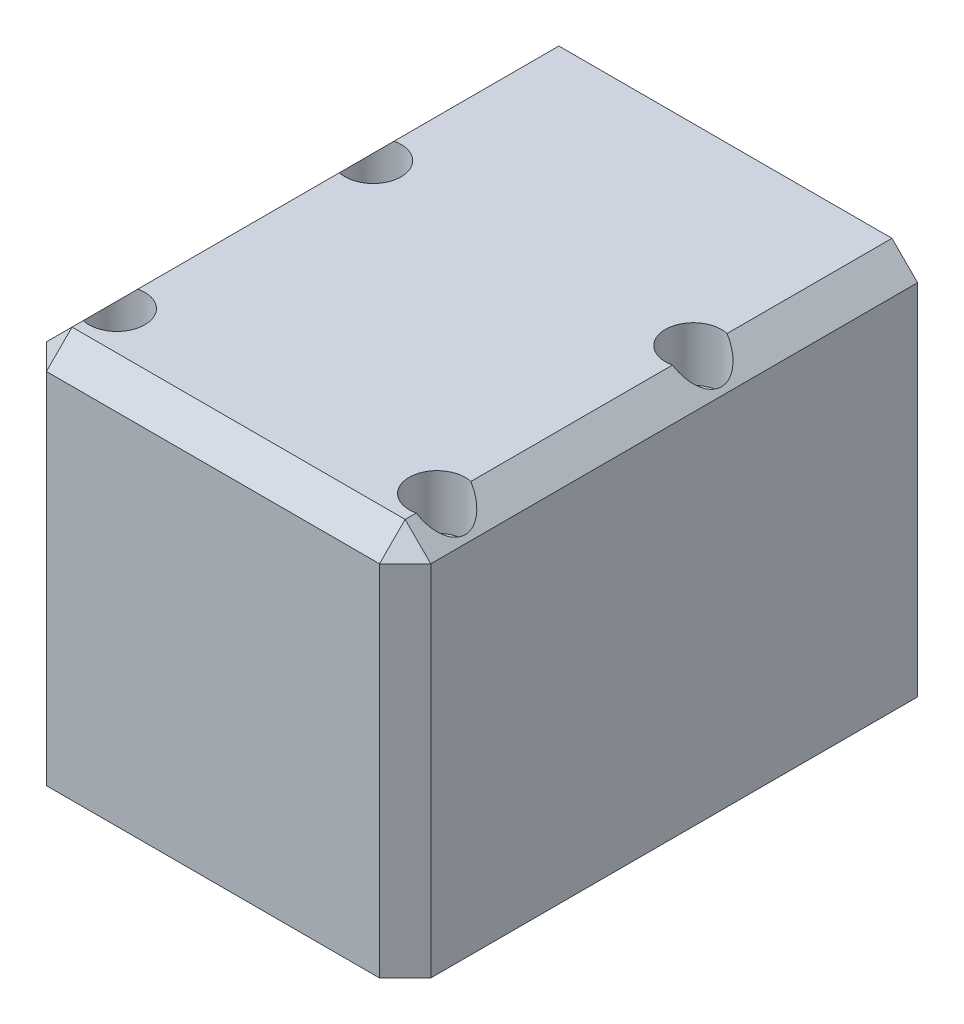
SolidWorks part; units mm, degrees
ref_plane "Front Plane" through (0, 0, 0) normal (0, 0, 1) x (1, 0, 0)
ref_plane "Top Plane" through (0, 0, 0) normal (0, 1, 0) x (1, 0, 0)
ref_plane "Right Plane" through (0, 0, 0) normal (1, 0, 0) x (0, 0, -1)
sketch "Sketch1" plane through (0, 0, 0) normal (0, 0, 1) x (1, 0, 0)
  line L1 (0, 0) -> (38.1, 0)
  line L2 (0, 0) -> (0, 38.1)
  line L3 (0, 38.1) -> (38.1, 38.1)
  line L4 (38.1, 0) -> (38.1, 38.1)
  dimension "D1" = 38.1
  dimension "D2" = 38.1
extrude "Extrude1" add sketch "Sketch1" along normal blind 50.8
sketch "Sketch2" plane through (0, 0, 0) normal (0, 0, -1) x (-1, 0, 0)
  line L0 (0, 19.05) -> (-13.4175, 19.05) construction
  line L1 (0, 38.1) -> (0, 0) construction
  line L2 (-19.05, 0) -> (-19.05, 14.7872) construction
  line L3 (0, 0) -> (-38.1, 0) construction
  circle A0 centre (-19.05, 19.05) radius 13.97
  dimension "D1" = 27.94
extrude "Cut-Extrude1" cut sketch "Sketch2" against normal blind 44.45
hole_wizard "#4-40 Tapped Hole1" positions "Sketch4" profile "Sketch3" tap size "#4-40" standard "Ansi Inch"
sketch "Sketch4" plane through (0, 0, 0) normal (0, 0, -1) x (-1, 0, 0)
  line L0 (-38.1, 19.05) -> (-2.1563, 19.05) construction
  line L1 (-38.1, 0) -> (-38.1, 38.1) construction
  line L2 (-19.05, 0) -> (-19.05, 27.8745) construction
  line L3 (0, 0) -> (-38.1, 0) construction
  point P0 (-6.745, 31.355)
  point P1 (-6.745, 6.745)
  point P2 (-31.355, 6.745)
  point P3 (-31.355, 31.355)
  dimension "D1" = 24.61
  dimension "D2" = 24.61
sketch "Sketch3" plane through (6.745, 31.355, 0) normal (1, 0, 0) x (0, 1, 0)
  line L0 (0, 0) -> (0, 9.5438)
  line L1 (0, 9.5438) -> (1.1303, 8.8646)
  line L2 (1.1303, 8.8646) -> (1.1303, 0)
  line L5 (1.1303, 0) -> (0, 0)
  line L10 (0, 9.5438) -> (-1.1303, 8.8646) construction
  line L11 (0, -6.35) -> (0, 107.95) construction
  dimension "Tap Drill Dia." = 2.2606
  dimension "Tap Drill Depth" = 8.8646
  dimension "Drill Angle" = 118
chamfer "Chamfer1" distance 2.54 angle 45 5 edges at (38.1, 19.05, 50.8) (0, 19.05, 50.8) (38.1, 38.1, 25.4) (19.05, 38.1, 50.8) (0, 38.1, 25.4)
sketch "Sketch5" plane through (0, 0, 0) normal (0, -1, 0) x (1, 0, 0)
  line L0 (19.05, 50.8) -> (19.05, 38.9511) construction
  line L1 (2.54, 50.8) -> (35.56, 50.8) construction
  circle A0 centre (19.05, 34.798) radius 9.525
  dimension "D1" = 19.05
  dimension "D2" = 16.002
extrude "Cut-Extrude2" cut sketch "Sketch5" against normal blind 12.7
hole_wizard "CBORE for #4 Socket Head Cap Screw1" positions "Sketch7" profile "Sketch6" counterbore size "#4" standard "Ansi Inch"
sketch "Sketch7" plane through (0, 38.1, 0) normal (0, 1, 0) x (-1, 0, 0)
  line L0 (-19.05, 50.8) -> (-19.05, 37.7192) construction
  line L1 (-35.56, 50.8) -> (-2.54, 50.8) construction
  point P0 (-34.925, 44.45)
  point P1 (-34.925, 19.05)
  point P2 (-3.175, 19.05)
  point P3 (-3.175, 44.45)
  dimension "D1" = 31.75
  dimension "D2" = 25.4
  dimension "D3" = 6.35
sketch "Sketch6" plane through (34.925, 38.1, 44.45) normal (1, 0, 0) x (0, 0, 1)
  line L0 (0, 0) -> (0, 38.1)
  line L1 (0, 38.1) -> (1.6319, 38.1)
  line L3 (1.6319, 38.1) -> (1.632, 5.3848)
  line L4 (1.632, 5.3848) -> (2.7788, 5.3848)
  line L5 (2.7788, 5.3848) -> (2.7788, 0)
  line L7 (2.7788, 0) -> (0, 0)
  line L11 (0, -6.35) -> (0, 107.95) construction
  dimension "Thru Hole Dia." = 3.2639
  dimension "Thru Hole Depth" = 38.1
  dimension "C'Bore Dia." = 5.5575
  dimension "C'Bore Depth" = 5.3848
